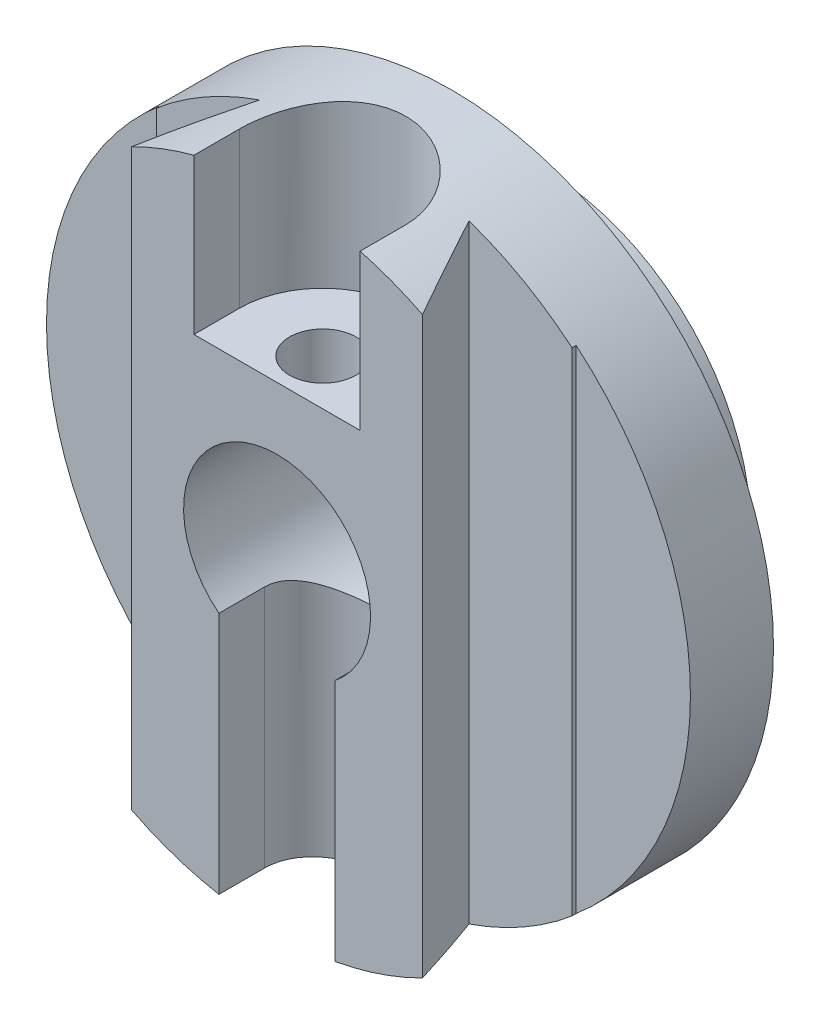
SolidWorks part; units mm, degrees
ref_plane "Front" through (0, 0, 0) normal (0, 0, 1) x (1, 0, 0)
ref_plane "Top" through (0, 0, 0) normal (0, 1, 0) x (1, 0, 0)
ref_plane "Right" through (0, 0, 0) normal (1, 0, 0) x (0, 0, -1)
sketch "Sketch2" plane through (0, 0, 0) normal (0, 1, 0) x (1, 0, 0)
  line L0 (0, 0) -> (77.5, 0)
  line L1 (77.5, 0) -> (77.5, 21)
  line L2 (77.5, 21) -> (50, 21)
  line L3 (50, 21) -> (50, 43)
  line L4 (50, 43) -> (0, 43)
  line L5 (0, 43) -> (0, 0)
  line L6 (0, -7.1464) -> (0, 26.0996) construction
  dimension "D1" = 155
  dimension "D2" = 100
  dimension "D3" = 21
  dimension "D4" = 43
revolve "Revolve1" add sketch "Sketch2" angle 360 about L6
sketch "Sketch3" plane through (0, 0, 0) normal (0, 1, 0) x (1, 0, 0)
  line L0 (0, 49.2216) -> (0, -32.1171) construction
  line L1 (25.2075, 0) -> (-25.2075, 0)
  line L2 (-25.2075, 0) -> (-35, -21)
  line L3 (-35, -21) -> (35, -21)
  line L4 (25.2075, 0) -> (35, -21)
  line L5 (-77.5, 0) -> (77.5, 0) construction
  line L6 (50, 43) -> (-50, 43) construction
  point P8 (0, -21)
  point P9 (0, 0)
  dimension "D1" = 65
  dimension "D2" = 70
  dimension "D3" = 64
extrude "Extrude1" add sketch "Sketch3" along normal up to surface and the other way up to surface
sketch "Sketch4" plane through (0, 0, 0) normal (0, 0, 1) x (1, 0, 0)
  line L0 (0, 89.58) -> (0, -89.58) construction
  line L1 (-50, 59.2136) -> (-50, -59.2136)
  line L2 (50, 59.2136) -> (50, -59.2136)
  arc A0 (-25.2075, 73.2859) -> (-25.2075, -73.2859) centre (0, 0) ccw construction
  arc A1 (-50, 59.2136) -> (-50, -59.2136) centre (0, 0) ccw
  arc A2 (50, 59.2136) -> (50, -59.2136) centre (0, 0) cw
  dimension "D1" = 100
extrude "Cut-Extrude1" cut sketch "Sketch4" against normal blind 1
ref_plane "Plane1" through (0, 77.5, 0) normal (0, 1, 0) x (-1, 0, 0)
sketch "Sketch6" plane through (0, 77.5, 0) normal (0, 1, 0) x (-1, 0, 0)
  line L0 (-20, 21) -> (-20, 10)
  line L1 (35, 21) -> (-35, 21) construction
  line L2 (20, 10) -> (20, 21)
  line L3 (20, 21) -> (-20, 21)
  arc A0 (-20, 10) -> (20, 10) centre (0, 10) ccw
  dimension "D1" = 20
  dimension "D2" = 11
extrude "Cut-Extrude2" cut sketch "Sketch6" against normal blind 40
sketch "Sketch7" plane through (0, 0, 0) normal (0, 1, 0) x (-1, 0, 0)
  line L0 (-14, 21) -> (-14, 10)
  line L1 (20, 21) -> (-20, 21) construction
  line L2 (14, 10) -> (14, 21)
  line L3 (14, 21) -> (-14, 21)
  arc A0 (-14, 10) -> (14, 10) centre (0, 10) ccw
  arc A1 (-20, 10) -> (20, 10) centre (0, 10) ccw construction
  dimension "D1" = 14
extrude "Cut-Extrude3" cut sketch "Sketch7" against normal through all
sketch "Sketch8" plane through (0, 0, 21) normal (0, 0, 1) x (1, 0, 0)
  circle A0 centre (0, 0) radius 22.5
  dimension "D1" = 45
extrude "Cut-Extrude4" cut sketch "Sketch8" against normal up to surface (42 mm away)
sketch "Sketch9" plane through (0, 0, -21) normal (0, 0, 1) x (1, 0, 0)
  circle A0 centre (0, 0) radius 11
  dimension "D1" = 22
extrude "Cut-Extrude5" cut sketch "Sketch9" against normal through all
sketch "Sketch10" plane through (0, 37.5, 0) normal (0, 1, 0) x (-1, 0, 0)
  circle A0 centre (0, 10) radius 8
  arc A1 (-20, 10) -> (20, 10) centre (0, 10) ccw construction
  dimension "D1" = 16
extrude "Cut-Extrude6" cut sketch "Sketch10" against normal through all
